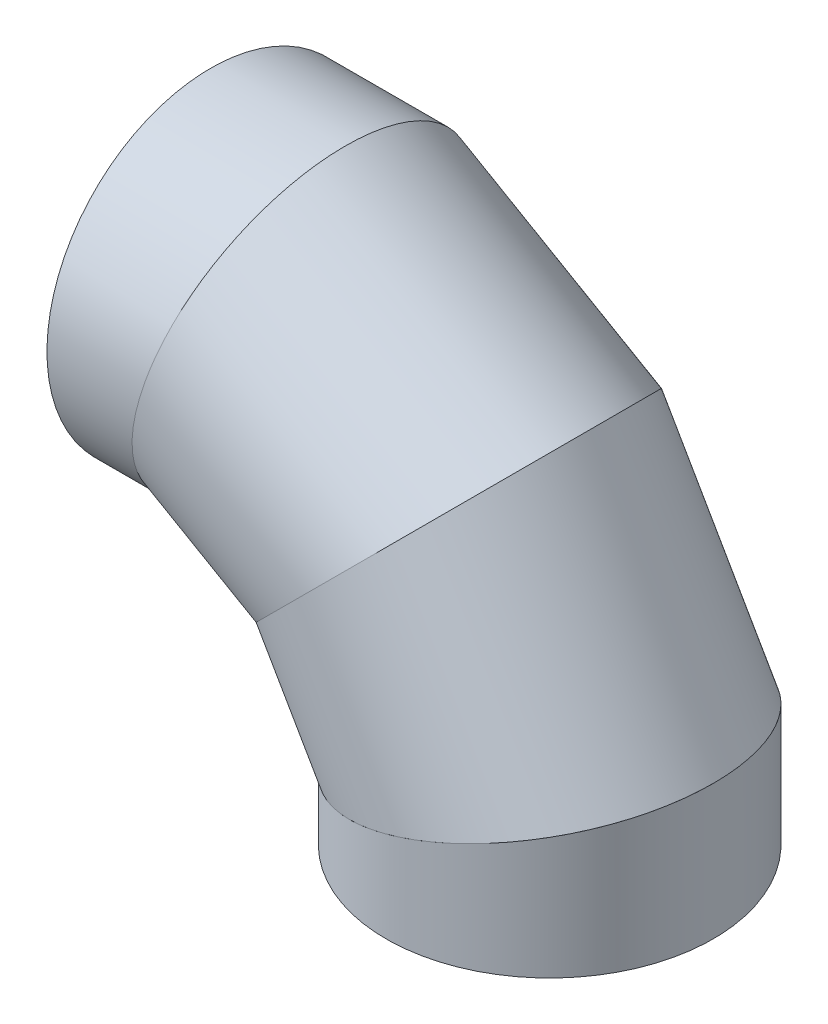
SolidWorks part; units mm, degrees
ref_plane "前视基准面" through (0, 0, 0) normal (0, 0, 1) x (1, 0, 0)
ref_plane "上视基准面" through (0, 0, 0) normal (0, 1, 0) x (1, 0, 0)
ref_plane "右视基准面" through (0, 0, 0) normal (1, 0, 0) x (0, 0, -1)
sketch "草图1" plane through (0, 0, 0) normal (0, 0, 1) x (1, 0, 0)
  line L0 (0, 0) -> (0, 850) construction
  line L1 (0, 1260) -> (0, 440) construction
  line L2 (0, 850) -> (227.7568, 850) construction
  line L3 (227.7568, 850) -> (622.2432, 622.2432) construction
  line L4 (622.2432, 622.2432) -> (850, 227.7568) construction
  line L5 (850, 227.7568) -> (850, 0) construction
  line L6 (850, 0) -> (0, 0) construction
  line L7 (227.7568, 850) -> (0, 0) construction
  line L8 (0, 0) -> (622.2432, 622.2432) construction
  line L9 (425, 736.1216) -> (0, 0) construction
  line L10 (0, 0) -> (850, 227.7568) construction
  line L11 (736.1216, 425) -> (0, 0) construction
  line L12 (425, 736.1216) -> (227.7568, 850) construction
  line L13 (0, 1260) -> (337.616, 1260) construction
  line L14 (337.616, 1260) -> (922.384, 922.384) construction
  line L15 (922.384, 922.384) -> (1260, 337.616) construction
  line L16 (1260, 337.616) -> (1260, 0) construction
  line L17 (1260, 0) -> (850, 0) construction
  line L18 (227.7568, 850) -> (337.616, 1260) construction
  line L19 (622.2432, 622.2432) -> (922.384, 922.384) construction
  line L20 (850, 227.7568) -> (1260, 337.616) construction
  line L21 (0, 440) -> (117.8976, 440) construction
  line L22 (117.8976, 440) -> (322.1024, 322.1024) construction
  line L23 (322.1024, 322.1024) -> (440, 117.8976) construction
  line L24 (440, 117.8976) -> (440, 0) construction
  line L25 (0, 0) -> (337.616, 1260)
  line L26 (736.1216, 425) -> (1091.192, 630) construction
  line L27 (425, 736.1216) -> (630, 1091.192) construction
  dimension "R0" = 850
  dimension "D" = 820
  dimension "φ" = 90
  dimension "β" = 15
sketch "草图2" plane through (0, 0, 0) normal (1, 0, 0) x (0, 0, -1)
  line L0 (0, 0) -> (-529.9781, 0) construction
  circle A0 centre (0, 850) radius 410
extrude "凸台-拉伸1" add sketch "草图2" along normal up to vertex
extrude "切除-拉伸1" cut sketch "草图1" against normal through all and the other way through all flip side to cut
ref_plane "基准面1" through (0, 0, 0) normal (0, 1, 0) x (-1, 0, 0)
sketch "草图3" plane through (0, 0, 0) normal (0, 1, 0) x (-1, 0, 0)
  circle A0 centre (-850, 0) radius 410
extrude "凸台-拉伸2" add sketch "草图3" along normal up to vertex separate body
sketch "草图4" plane through (0, 0, 0) normal (0, 0, 1) x (1, 0, 0)
  line L0 (0, 0) -> (1260, 337.616)
extrude "切除-拉伸2" cut sketch "草图4" against normal through all and the other way through all
ref_plane "基准面2" through (0, 0, 0) normal (0.5, -0.866, 0) x (0.866, 0.5, 0)
sketch "草图5" plane through (0, 0, 0) normal (0.5, -0.866, 0) x (0.866, 0.5, 0)
  circle A0 centre (850, 0) radius 410
extrude "凸台-拉伸3" add sketch "草图5" along normal up to vertex and the other way up to vertex separate body
sketch "草图6" plane through (0, 0, 0) normal (0, 0, 1) x (1, 0, 0)
  line L0 (0, 0) -> (1260, 337.616)
  line L1 (1260, 337.616) -> (922.384, 922.384)
  line L2 (922.384, 922.384) -> (0, 0)
extrude "切除-拉伸3" cut sketch "草图6" against normal through all and the other way through all flip side to cut
ref_plane "基准面3" through (0, 0, 0) normal (-0.866, 0.5, 0) x (0, 0, 1)
sketch "草图10" plane through (0, 0, 0) normal (-0.866, 0.5, 0) x (0, 0, 1)
  circle A0 centre (0, 850) radius 410
extrude "凸台-拉伸4" add sketch "草图10" along normal up to vertex and the other way up to vertex separate body
sketch "草图11" plane through (0, 0, 0) normal (0, 0, 1) x (1, 0, 0)
  line L0 (0, 0) -> (922.384, 922.384)
  line L1 (922.384, 922.384) -> (337.616, 1260)
  line L2 (337.616, 1260) -> (0, 0)
extrude "切除-拉伸4" cut sketch "草图11" against normal through all and the other way through all flip side to cut
shell "抽壳1" thickness 1
shell "抽壳2" thickness 1
shell "抽壳3" thickness 1
shell "抽壳4" thickness 1
sketch "草图12" plane through (0, 0, 0) normal (1, 0, 0) x (0, 0, -1)
  line L0 (0, 850) -> (0, 0)
extrude "切除-拉伸-薄壁1" cut sketch "草图12" along normal up to vertex thin
sketch "草图13" plane through (0, 0, 0) normal (-0.866, 0.5, 0) x (0, 0, 1)
  line L0 (0, 0) -> (0, 850)
extrude "切除-拉伸-薄壁2" cut sketch "草图13" against normal up to vertex and the other way up to vertex thin
sketch "草图14" plane through (0, 0, 0) normal (0.5, -0.866, 0) x (0.866, 0.5, 0)
  line L0 (0, 0) -> (850, 0)
extrude "切除-拉伸-薄壁3" cut sketch "草图14" against normal up to vertex and the other way up to vertex thin
sketch "草图15" plane through (0, 0, 0) normal (0, 1, 0) x (-1, 0, 0)
  line L0 (0, 0) -> (-850, 0)
extrude "切除-拉伸-薄壁4" cut sketch "草图15" along normal up to vertex thin
equation "\"β@草图1\" = \"φ@草图1\"/6"
equation "\"D1@抽壳2\" = \"D1@抽壳1\""
equation "\"D1@抽壳3\" = \"D1@抽壳1\""
equation "\"D1@抽壳4\" = \"D1@抽壳1\""
